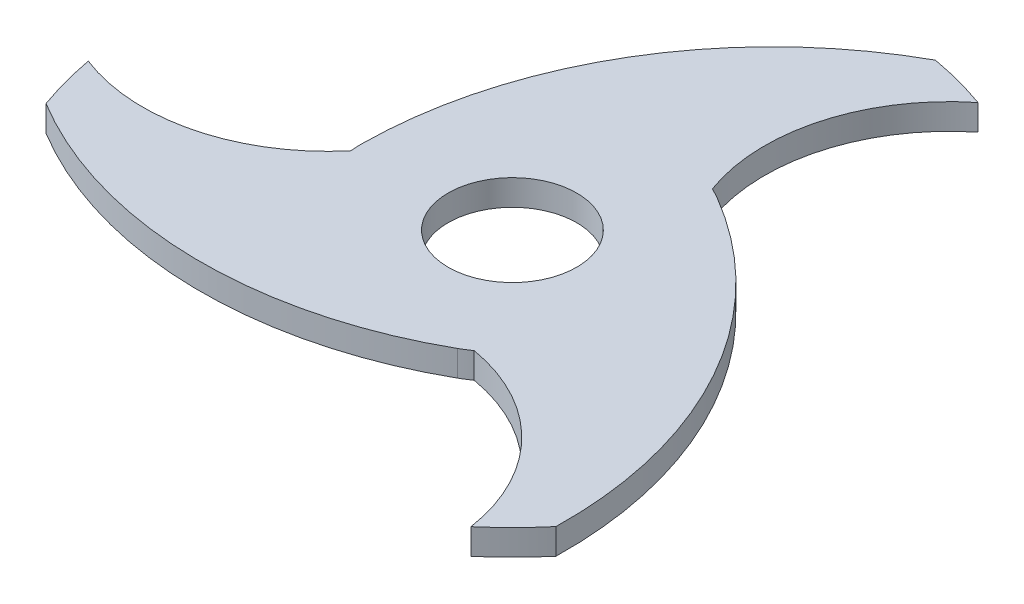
SolidWorks part; units mm, degrees
ref_plane "Front" through (0, 0, 0) normal (0, 0, 1) x (1, 0, 0)
ref_plane "Top" through (0, 0, 0) normal (0, 1, 0) x (1, 0, 0)
ref_plane "Right" through (0, 0, 0) normal (1, 0, 0) x (0, 0, -1)
sketch "Sketch1" plane through (0, 0, 0) normal (0, 1, 0) x (1, 0, 0)
  line L0 (0, 46.5316) -> (0, -59.3074) construction
  line L1 (-60.4329, 0) -> (85.3554, 0) construction
  line L2 (7.5, 50.8341) -> (7.5, -53.4515) construction
  circle A0 centre (0, 0) radius 7.5
  arc A1 (-17.4926, 0.5103) -> (-17.4431, -1.4105) centre (0, 0) ccw
  arc A2 (14.265, 40.0345) -> (7.5, 41.833) centre (0, 0) ccw
  arc A3 (7.5, 15.8114) -> (14.265, 40.0345) centre (27.704, 23.2251) cw
  arc A4 (7.5, 41.833) -> (-17.5, 0) centre (30.7504, -0.4485) ccw
  arc A5 (-41.8034, -7.6634) -> (-39.9784, -14.4213) centre (0, 0) ccw
  arc A6 (32.4784, -27.4117) -> (8.75, 15.1554) centre (-15.7636, -26.4064) ccw
  arc A7 (27.5384, -32.3711) -> (32.4784, -27.4117) centre (0, 0) ccw
  arc A8 (9.9431, -14.4009) -> (27.5384, -32.3711) centre (6.2615, -35.6049) cw
  arc A9 (-39.9784, -14.4213) -> (8.75, -15.1554) centre (-14.9868, 26.8549) ccw
  arc A10 (-41.8034, -7.6634) -> (-39.9784, -14.4213) centre (0, 0) ccw
  arc A11 (-17.4431, -1.4105) -> (-41.8034, -7.6634) centre (-33.9655, 12.3798) cw
  arc A12 (27.5384, -32.3711) -> (32.4784, -27.4117) centre (0, 0) ccw
  arc A13 (7.5, -15.8114) -> (9.9431, -14.4009) centre (0, 0) ccw
  arc A14 (9.1883, 14.8938) -> (7.5, 15.8114) centre (0, 0) ccw
  point P9 (17.5, 0)
  point P10 (42.5, 0)
  point P16 (7.5, 41.833)
  point P35 (0, 0)
  dimension "D1" = 15
  dimension "D2" = 35
  dimension "D3" = 25
  dimension "D4" = 7
  dimension "D5" = 3
extrude "Boss-Extrude1" add sketch "Sketch1" along normal blind 3
